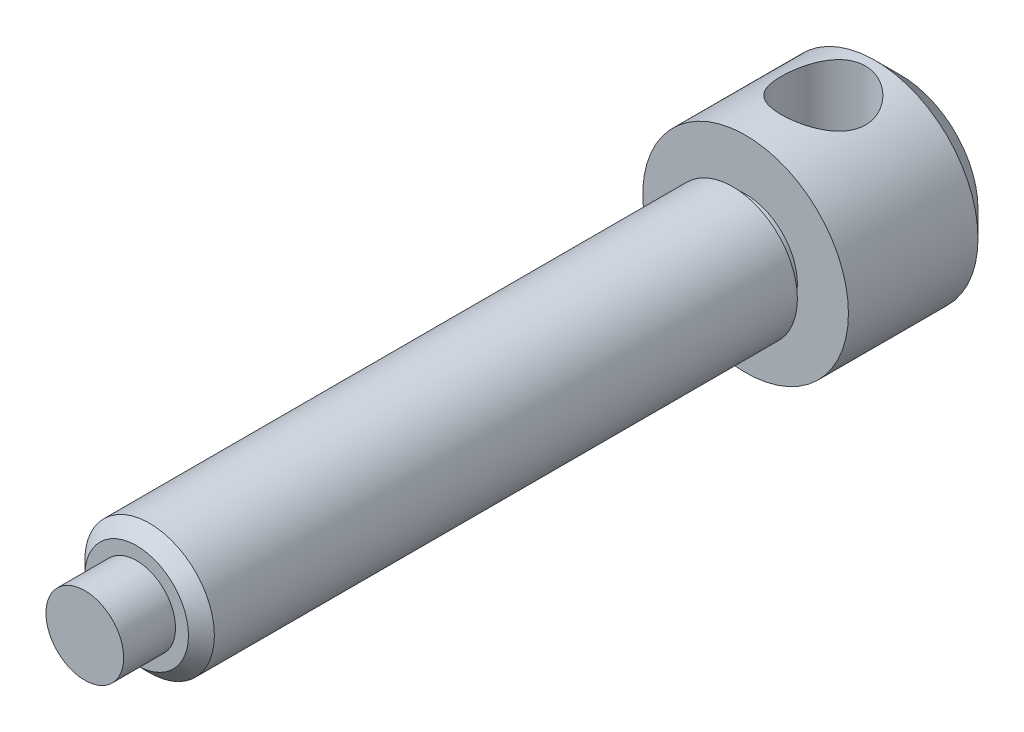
SolidWorks part; units mm, degrees
ref_plane "Plano frontal" through (0, 0, 0) normal (0, 0, 1) x (1, 0, 0)
ref_plane "Plano superior" through (0, 0, 0) normal (0, 1, 0) x (1, 0, 0)
ref_plane "Plano direito" through (0, 0, 0) normal (1, 0, 0) x (0, 0, -1)
sketch "Esboço1" plane through (0, 0, 0) normal (0, 0, 1) x (1, 0, 0)
  circle A0 centre (0, 0) radius 7.9375
  dimension "D1" = 15.875
extrude "Ressalto-extrusão1" add sketch "Esboço1" along normal blind 12
sketch "Esboço2" plane through (0, 0, 12) normal (0, 0, 1) x (1, 0, 0)
  circle A0 centre (0, 0) radius 4
  dimension "D1" = 8
extrude "Ressalto-extrusão2" add sketch "Esboço2" along normal blind 1
sketch "Esboço3" plane through (0, 0, 13) normal (0, 0, 1) x (1, 0, 0)
  circle A0 centre (0, 0) radius 5
  dimension "D1" = 10
extrude "Ressalto-extrusão3" add sketch "Esboço3" along normal blind 46
sketch "Esboço4" plane through (0, 0, 59) normal (0, 0, 1) x (1, 0, 0)
  circle A0 centre (0, 0) radius 3
  dimension "D1" = 6
extrude "Ressalto-extrusão4" add sketch "Esboço4" along normal blind 4
sketch "Esboço5" plane through (0, 0, 0) normal (0, 1, 0) x (1, 0, 0)
  circle A0 centre (0, -6) radius 3.25
  dimension "D3" = 6.5
  dimension "D1" = 0
  dimension "D2" = 6
extrude "Corte-extrusão1" cut sketch "Esboço5" against normal through all both and the other way through all
chamfer "Chanfro1" distance 2 angle 45 1 edges at (7.9375, 0, 0)
chamfer "Chanfro2" distance 1 angle 45 1 edges at (5, 0, 59)
